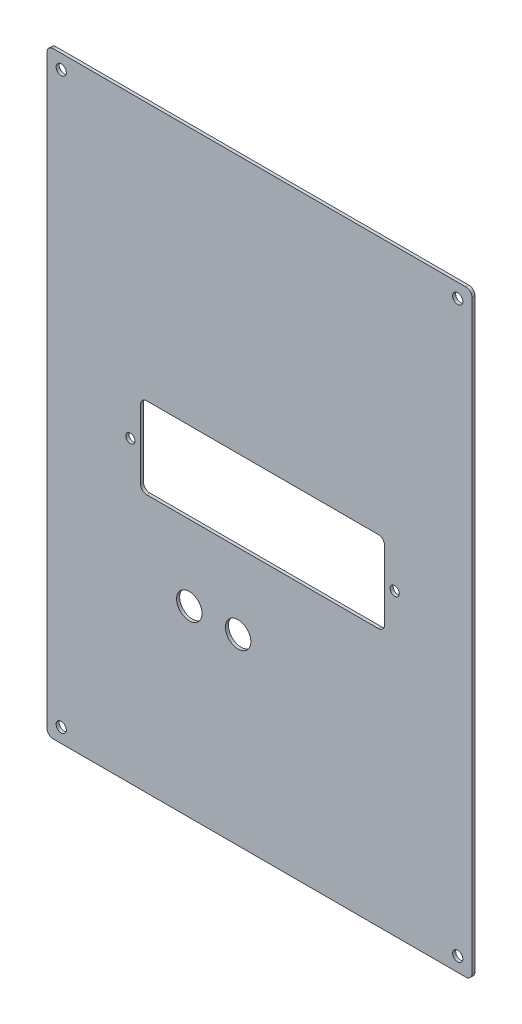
SolidWorks part; units mm, degrees
ref_plane "Plan de face" through (0, 0, 0) normal (0, 0, 1) x (1, 0, 0)
ref_plane "Plan de dessus" through (0, 0, 0) normal (0, 1, 0) x (1, 0, 0)
ref_plane "Plan de droite" through (0, 0, 0) normal (1, 0, 0) x (0, 0, -1)
sketch "Esquisse1" plane through (0, 0, 0) normal (0, 0, 1) x (1, 0, 0)
  line L1 (3, 0) -> (206, 0)
  line L2 (0, 3) -> (0, 63.5)
  line L3 (3, 294) -> (206, 294)
  line L4 (209, 3) -> (209, 291)
  line L7 (7, 287) -> (202, 287) construction
  line L8 (7, 287) -> (7, 7) construction
  line L9 (7, 7) -> (202, 7) construction
  line L10 (202, 287) -> (202, 7) construction
  line L12 (0, 63.5) -> (0, 291)
  arc A0 (209, 291) -> (206, 294) centre (206, 291) ccw
  arc A1 (206, 0) -> (209, 3) centre (206, 3) ccw
  arc A2 (3, 0) -> (0, 3) centre (3, 3) cw
  arc A3 (0, 291) -> (3, 294) centre (3, 291) cw
  circle A4 centre (7, 287) radius 2.5
  circle A5 centre (202, 287) radius 2.5
  circle A6 centre (202, 7) radius 2.5
  circle A7 centre (7, 7) radius 2.5
  point P9 (209, 0)
  point P12 (0, 0)
  point P15 (0, 294)
  dimension "D3" = 3
  dimension "D4" = 7
  dimension "D12" = 5
  dimension "D13" = 5
  dimension "D14" = 5
  dimension "D15" = 5
  dimension "D1" = 209
  dimension "D2" = 294
  dimension "D5" = 7
  dimension "D6" = 7
  dimension "D7" = 7
extrude "Boss.-Extru.1" add sketch "Esquisse1" along normal blind 1.5
sketch "Esquisse2" plane through (0, 0, 1.5) normal (0, 0, 1) x (1, 0, 0)
  line L0 (0, 90) -> (98.7753, 90) construction
  line L1 (0, 291) -> (0, 3) construction
  line L2 (3, 0) -> (206, 0) construction
  circle A0 centre (70, 90) radius 6.25
  circle A1 centre (94, 90) radius 6.25
  dimension "D1" = 90
  dimension "D2" = 12.5
  dimension "D3" = 24
  dimension "D4" = 70
extrude "Enlèv. mat.-Extru.1" cut sketch "Esquisse2" against normal up to next
sketch "Esquisse3" plane through (0, 0, 1.5) normal (0, 0, 1) x (1, 0, 0)
  line L0 (0, 147) -> (209, 147) construction
  line L1 (0, 291) -> (0, 3) construction
  line L2 (209, 3) -> (209, 291) construction
  line L3 (206, 294) -> (3, 294) construction
  line L5 (49, 167) -> (163, 167)
  line L6 (46, 164) -> (46, 130)
  line L7 (49, 127) -> (163, 127)
  line L8 (166, 164) -> (166, 130)
  arc A0 (163, 127) -> (166, 130) centre (163, 130) ccw
  arc A1 (166, 164) -> (163, 167) centre (163, 164) ccw
  arc A2 (49, 127) -> (46, 130) centre (49, 130) cw
  arc A3 (46, 164) -> (49, 167) centre (49, 164) cw
  circle A4 centre (41, 147) radius 2.25
  circle A5 centre (171, 147) radius 2.25
  point P6 (104.5, 147)
  point P15 (166, 127)
  point P18 (166, 167)
  point P21 (46, 127)
  dimension "D5" = 3
  dimension "D6" = 4.5
  dimension "D7" = 4.5
  dimension "D8" = 5
  dimension "D9" = 5
  dimension "D4" = 130
  dimension "D1" = 147
  dimension "D2" = 40
  dimension "D3" = 46
extrude "Enlèv. mat.-Extru.2" cut sketch "Esquisse3" against normal up to next
